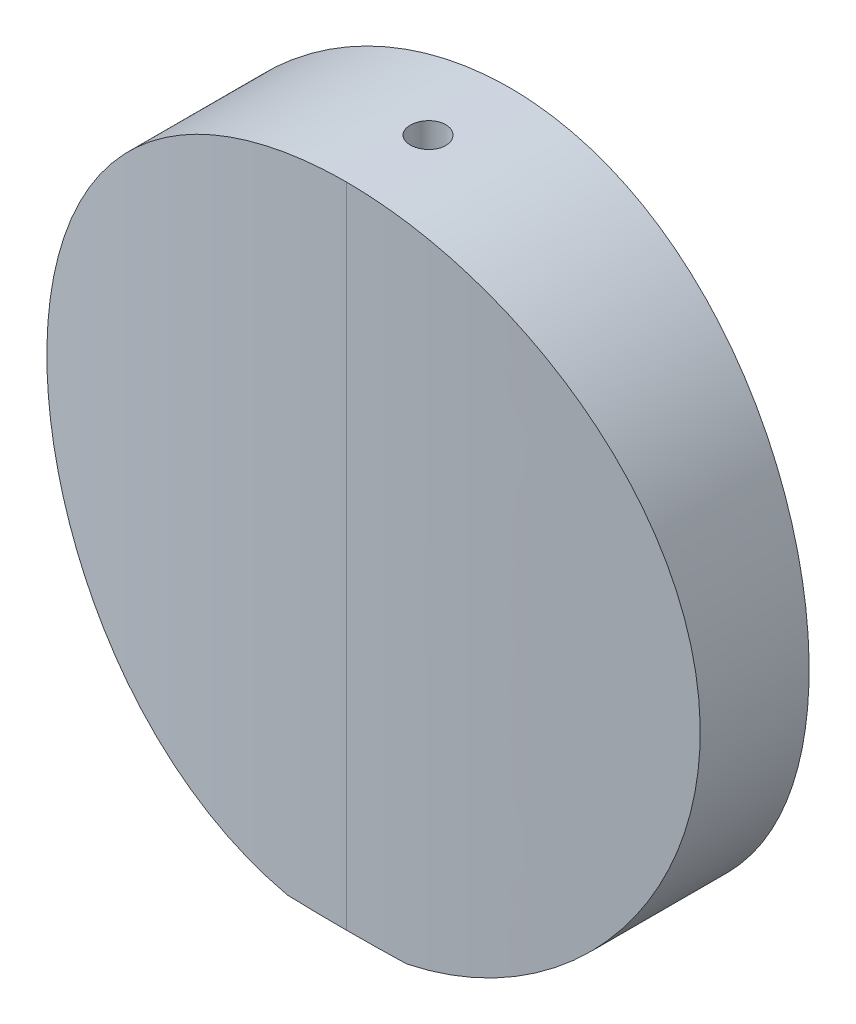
SolidWorks part; units mm, degrees
ref_plane "Спереди" through (0, 0, 0) normal (0, 0, 1) x (1, 0, 0)
ref_plane "Сверху" through (0, 0, 0) normal (0, 1, 0) x (1, 0, 0)
ref_plane "Справа" through (0, 0, 0) normal (1, 0, 0) x (0, 0, -1)
sketch "Эскиз1" plane through (0, 0, 0) normal (0, 1, 0) x (1, 0, 0)
  line L0 (-60, 10) -> (-60, -10)
  line L1 (0, 33.8021) -> (0, -29.6481) construction
  line L2 (-60, 0) -> (60, 0) construction
  line L3 (4.4079, 15) -> (-4.4079, 15) construction
  line L4 (60, 10) -> (60, -10)
  circle A0 centre (0, 0) radius 3.25
  spline S0 degree 2 poles (-60, 10) (-30.8552, 15) (0, 15) knots 0 0 0 1 1 1
  spline S1 degree 2 poles (-60, -10) (-30.8552, -15) (0, -15) knots 0 0 0 1 1 1
  spline S2 degree 2 poles (-60, 10) (-30.8552, 15) (0, 15) knots 0 0 0 1 1 1
  spline S3 degree 2 poles (-60, -10) (-30.8552, -15) (0, -15) knots 0 0 0 1 1 1
  spline S4 degree 2 poles (60, -10) (30.8552, -15) (0, -15) knots 0 0 0 1 1 1
  spline S5 degree 2 poles (60, 10) (30.8552, 15) (0, 15) knots 0 0 0 1 1 1
  spline S6 degree 2 poles (60, -10) (30.8552, -15) (0, -15) knots 0 0 0 1 1 1
  spline S7 degree 2 poles (60, 10) (30.8552, 15) (0, 15) knots 0 0 0 1 1 1
  dimension "D1" = 6.5
  dimension "D2" = 20
  dimension "D3" = 60
  dimension "D4" = 30
extrude "Бобышка-Вытянуть2" add sketch "Эскиз1" along normal blind 120 contours L4 S5 S0 L0 S1 S4 A0
sketch "Эскиз5" plane through (0, 0, 0) normal (0, 0, 1) x (1, 0, 0)
  line L2 (0, 0) -> (60, 0) construction
  line L3 (0, 120) -> (0, 0) construction
  circle A0 centre (0, 59) radius 60
  dimension "D1" = 120
  dimension "D2" = 59
extrude "Вырез-Вытянуть2" cut sketch "Эскиз5" against normal mid plane 120 flip side to cut contours A0
